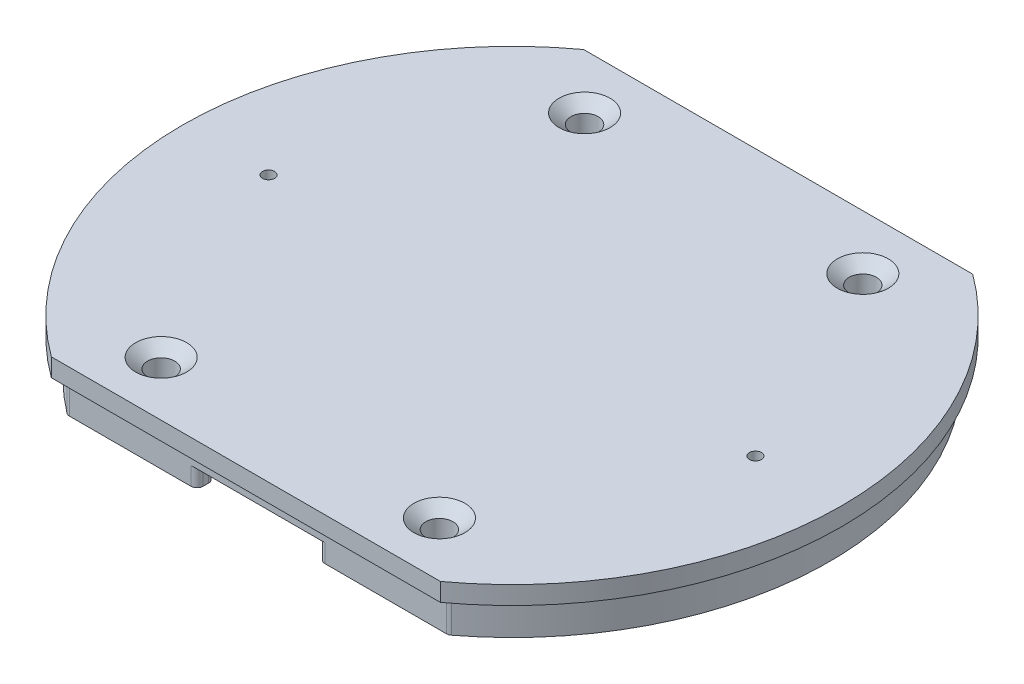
SolidWorks part; units mm, degrees
other "<a_base_t42>-<#8 Clearance Hole1>"
ref_plane "Front Plane" through (0, 0, 0) normal (0, 0, 1) x (1, 0, 0)
ref_plane "Top Plane" through (0, 0, 0) normal (0, 1, 0) x (1, 0, 0)
ref_plane "Right Plane" through (0, 0, 0) normal (1, 0, 0) x (0, 0, -1)
inserted part "a_base_t42"
inserted part "params_finger_t42"
sketch "Sketch1" plane through (0, 0, 0) normal (0, -1, 0) x (1, 0, 0)
  circle A0 centre (-23, 35) radius 2.2479 construction
  circle A1 centre (23, 35) radius 2.2479 construction
  circle A2 centre (23, -35) radius 2.2479 construction
  circle A3 centre (-23, -35) radius 2.2479 construction
  circle A4 centre (-23, 35) radius 2.2479
  circle A5 centre (23, 35) radius 2.2479
  circle A6 centre (23, -35) radius 2.2479
  circle A7 centre (-23, -35) radius 2.2479
  circle A8 centre (-23, 35) radius 5.2479
  circle A9 centre (23, 35) radius 5.2479
  circle A10 centre (23, -35) radius 5.2479
  circle A11 centre (-23, -35) radius 5.2479
  dimension "D1" = 3
extrude "Support Post Boss" add sketch "Sketch1" along normal blind 3
sketch "Sketch2" plane through (0, 0, 0) normal (0, -1, 0) x (1, 0, 0)
  line L0 (29.4321, 36) -> (-29.4321, 36)
  line L1 (-29.4321, -36) -> (29.4321, -36)
  line L2 (31.5, 42) -> (-31.5, 42)
  line L3 (-31.5, -42) -> (31.5, -42)
  line L4 (31.5, 42) -> (-31.5, 42)
  line L5 (-31.5, -42) -> (31.5, -42)
  arc A0 (-29.4321, 36) -> (-29.4321, -36) centre (0, 0) ccw
  arc A1 (29.4321, -36) -> (29.4321, 36) centre (0, 0) ccw
  arc A2 (31.5, -42) -> (31.5, 42) centre (0, 0) ccw
  arc A3 (-31.5, 42) -> (-31.5, -42) centre (0, 0) ccw
  arc A4 (31.5, -42) -> (31.5, 42) centre (0, 0) ccw
  arc A5 (-31.5, 42) -> (-31.5, -42) centre (0, 0) ccw
  dimension "D1" = 0
  dimension "D2" = 6
extrude "Inner Boss" add sketch "Sketch2" along normal up to surface (3 mm away)
sketch "Sketch3" plane through (0, 3, 0) normal (0, 1, 0) x (1, 0, 0)
  circle A0 centre (23, -35) radius 2.2479 construction
  circle A1 centre (-23, -35) radius 2.2479 construction
  circle A2 centre (-23, 35) radius 2.2479 construction
  circle A3 centre (23, 35) radius 2.2479 construction
  circle A4 centre (23, -35) radius 2.2479
  circle A5 centre (-23, -35) radius 2.2479
  circle A6 centre (-23, 35) radius 2.2479
  circle A7 centre (23, 35) radius 2.2479
extrude "Clearance - Support Restoration" cut sketch "Sketch3" against normal through all
sketch "Sketch4" plane through (0, 3, 0) normal (0, 1, 0) x (1, 0, 0)
  line L1 (-32.1598, -44) -> (32.1598, -44)
  line L2 (32.1598, 44) -> (-32.1598, 44)
  line L3 (-31.5, -42) -> (31.5, -42)
  line L4 (31.5, 42) -> (-31.5, 42)
  line L5 (-31.5, -42) -> (31.5, -42)
  line L6 (31.5, 42) -> (-31.5, 42)
  arc A0 (32.1598, -44) -> (32.1598, 44) centre (0, 0) ccw
  arc A1 (-32.1598, 44) -> (-32.1598, -44) centre (0, 0) ccw
  arc A2 (31.5, -42) -> (31.5, 42) centre (0, 0) ccw
  arc A3 (-31.5, 42) -> (-31.5, -42) centre (0, 0) ccw
  arc A4 (31.5, -42) -> (31.5, 42) centre (0, 0) ccw
  arc A5 (-31.5, 42) -> (-31.5, -42) centre (0, 0) ccw
  dimension "D1" = 0
  dimension "D2" = 2
extrude "Outer Shell Lip" add sketch "Sketch4" against normal blind 3
sketch "Sketch5" plane through (0, -3, 0) normal (0, -1, 0) x (1, 0, 0)
  line L0 (30.5094, 39.075) -> (-30.5094, 39.075)
  line L1 (-30.5094, -39.075) -> (30.5094, -39.075)
  line L2 (-31.5, -42) -> (31.5, -42)
  line L3 (31.5, 42) -> (-31.5, 42)
  line L4 (-31.5, -42) -> (31.5, -42)
  line L5 (31.5, 42) -> (-31.5, 42)
  arc A0 (-30.5094, 39.075) -> (-30.5094, -39.075) centre (0, 0) ccw
  arc A1 (30.5094, -39.075) -> (30.5094, 39.075) centre (0, 0) ccw
  arc A2 (31.5, -42) -> (31.5, 42) centre (0, 0) ccw
  arc A3 (-31.5, 42) -> (-31.5, -42) centre (0, 0) ccw
  arc A4 (31.5, -42) -> (31.5, 42) centre (0, 0) ccw
  arc A5 (-31.5, 42) -> (-31.5, -42) centre (0, 0) ccw
  dimension "D1" = 0
  dimension "D2" = 2.925
extrude "Inner Boss Outer Frame" add sketch "Sketch5" along normal blind 3
sketch "Sketch6" plane through (0, -6, 0) normal (0, -1, 0) x (1, 0, 0)
  line L0 (0, 42) -> (0, 0) construction
  line L1 (31.5, 42) -> (-31.5, 42) construction
  line L2 (0, 0) -> (52.5, 0) construction
  line L3 (30.5094, 39.075) -> (-30.5094, 39.075) construction
  line L4 (-10.075, 42) -> (10.075, 42)
  line L5 (-10.075, 42) -> (-10.075, 39.075)
  line L6 (-10.075, 39.075) -> (10.075, 39.075)
  line L7 (10.075, 42) -> (10.075, 39.075)
  line L8 (-10.075, -42) -> (-10.075, -39.075)
  line L9 (-10.075, -39.075) -> (10.075, -39.075)
  line L10 (10.075, -42) -> (10.075, -39.075)
  line L11 (-10.075, -42) -> (10.075, -42)
  arc A0 (31.5, -42) -> (31.5, 42) centre (0, 0) ccw construction
  dimension "D1" = 20.15
extrude "Clearance - Flange" cut sketch "Sketch6" against normal up to surface (3 mm away)
fillet "Contouring" radius 1 12 edges at (-10.075, -4.5, 39.075) (-10.075, -4.5, 42) (10.075, -4.5, 42) (10.075, -4.5, 39.075) (10.075, -4.5, -42) (-10.075, -4.5, -42) (-10.075, -4.5, -39.075) (10.075, -4.5, -39.075) (-31.5, -3, -42) (31.5, -3, -42) (-31.5, -3, 42) (31.5, -3, 42)
hole_wizard "CSK for #8 Flat Head Machine Screw (100)1" positions "Sketch8" profile "Sketch7" countersink size "#8" standard "ANSI Inch"
sketch "Sketch8" plane through (0, 3, 0) normal (0, 1, 0) x (1, 0, 0)
  point P0 (-23, 35)
  point P3 (23, 35)
  point P6 (23, -35)
  point P9 (-23, -35)
sketch "Sketch7" plane through (-23, 3, -35) normal (1, 0, 0) x (0, 0, 1)
  line L0 (0, 0) -> (0, 9)
  line L1 (0, 9) -> (2.1526, 9)
  line L2 (2.1526, 9) -> (2.1526, 1.7317)
  line L3 (2.1526, 1.7317) -> (4.2164, 0)
  line L5 (4.2164, 0) -> (0, 0)
  line L6 (-2.1527, 1.7317) -> (-4.2164, 0) construction
  line L11 (0, -6.35) -> (0, 107.95) construction
  dimension "Thru Hole Dia." = 4.3053
  dimension "Thru Hole Depth" = 9
  dimension "Near C'Sink Dia." = 8.4328
  dimension "Near C'Sink Angle" = 100
ref_point "Point1"
sketch "Sketch9" [suppressed] plane through (0, 3, 0) normal (0, 1, 0) x (1, 0, 0)
  line L0 (0, -44) -> (0, 44) construction
  line L1 (-32.1598, -44) -> (32.1598, -44) construction
  line L2 (32.1598, 44) -> (-32.1598, 44) construction
  line L3 (0, 0) -> (-54.5, 0) construction
  line L4 (41.75, -15.95) -> (41.75, 15.95)
  line L5 (-41.75, -15.95) -> (-12.0751, -15.95)
  line L6 (-41.75, -15.95) -> (-41.75, 15.95)
  line L7 (-41.75, 15.95) -> (-12.0751, 15.95)
  line L8 (-12.0751, -15.95) -> (-12.0751, 15.95)
  line L9 (41.75, 15.95) -> (12.0751, 15.95)
  line L10 (12.0751, -15.95) -> (12.0751, 15.95)
  line L11 (41.75, -15.95) -> (12.0751, -15.95)
  arc A0 (-32.1598, 44) -> (-32.1598, -44) centre (0, 0) ccw construction
  circle A1 centre (-40.25, 0) radius 1 construction
  point P17 (-38.75, 0)
  dimension "D1" = 1.5
  dimension "D2" = 31.9
  dimension "D3" = 38.75
  dimension "D4" = 26.6749
extrude "Clearance - Flexure Base" [suppressed] cut sketch "Sketch9" against normal up to surface (3 mm away)
sketch "Sketch10" [suppressed] plane through (0, 0, 0) normal (0, -1, 0) x (1, 0, 0)
  line L0 (0, -36) -> (0, 0) construction
  line L1 (-17.8483, -36) -> (17.8483, -36) construction
  line L2 (-41.75, -15.95) -> (-12.0751, -15.95) construction
  line L3 (-8.0751, -15.95) -> (-45.75, -15.95)
  line L4 (-8.0751, -15.95) -> (-8.0751, 15.95)
  line L5 (-8.0751, 15.95) -> (-45.75, 15.95)
  line L6 (-45.75, -15.95) -> (-45.75, 15.95)
  line L7 (-12.0751, 15.95) -> (-41.75, 15.95) construction
  line L8 (-12.0751, -15.95) -> (-12.0751, 15.95) construction
  line L9 (-41.75, 15.95) -> (-41.75, -15.95) construction
  line L10 (-5.0751, -18.95) -> (-48.75, -18.95)
  line L11 (-48.75, -18.95) -> (-48.75, 18.95)
  line L12 (-5.0751, 18.95) -> (-48.75, 18.95)
  line L13 (-5.0751, -18.95) -> (-5.0751, 18.95)
  line L14 (8.0751, -15.95) -> (8.0751, 15.95)
  line L15 (8.0751, 15.95) -> (45.75, 15.95)
  line L16 (45.75, -15.95) -> (45.75, 15.95)
  line L17 (8.0751, -15.95) -> (45.75, -15.95)
  line L18 (5.0751, -18.95) -> (5.0751, 18.95)
  line L19 (5.0751, 18.95) -> (48.75, 18.95)
  line L20 (48.75, -18.95) -> (48.75, 18.95)
  line L21 (5.0751, -18.95) -> (48.75, -18.95)
  dimension "D1" = 4
  dimension "D2" = 4
  dimension "D3" = 3
extrude "Framing - Flexure Base" [suppressed] add sketch "Sketch10" along normal up to surface (3 mm away)
sketch "Sketch11" [suppressed] plane through (0, -3, 0) normal (0, -1, 0) x (1, 0, 0)
  line L0 (41.75, -15.95) -> (41.75, 15.95) construction
  line L1 (41.75, -15.95) -> (41.75, 15.95)
  line L2 (0, 0) -> (0, -36) construction
  line L3 (-17.8483, -36) -> (17.8483, -36) construction
  line L4 (41.75, -15.95) -> (45.75, -15.95)
  line L5 (45.75, -15.95) -> (45.75, 15.95)
  line L6 (45.75, 15.95) -> (41.75, 15.95)
  line L7 (45.75, -8.3179) -> (45.75, 8.3179) construction
  line L8 (-45.75, 15.95) -> (-41.75, 15.95)
  line L9 (-45.75, -15.95) -> (-45.75, 15.95)
  line L10 (-41.75, -15.95) -> (-45.75, -15.95)
  line L11 (-41.75, -15.95) -> (-41.75, 15.95)
extrude "Clearance - Flexure Tab" [suppressed] cut sketch "Sketch11" against normal up to surface (3 mm away)
sketch "Sketch12" [suppressed] plane through (0, 3, 0) normal (0, 1, 0) x (1, 0, 0)
  line L0 (0, -44) -> (0, 0) construction
  line L1 (-32.1598, -44) -> (32.1598, -44) construction
  line L2 (0, 0) -> (54.5, 0) construction
  line L3 (-41.75, -15.95) -> (-41.75, 15.95)
  line L4 (41.75, -15.95) -> (20.85, -15.95)
  line L5 (41.75, -15.95) -> (41.75, 15.95)
  line L6 (41.75, 15.95) -> (20.85, 15.95)
  line L7 (20.85, -15.95) -> (20.85, 15.95)
  line L8 (-41.75, 15.95) -> (-20.85, 15.95)
  line L9 (-20.85, -15.95) -> (-20.85, 15.95)
  line L10 (-41.75, -15.95) -> (-20.85, -15.95)
  arc A0 (32.1598, -44) -> (32.1598, 44) centre (0, 0) ccw construction
  circle A1 centre (40.25, 0) radius 1 construction
  point P15 (30, 0)
  dimension "D1" = 1.5
  dimension "D2" = 31.9
  dimension "D3" = 30
  dimension "D4" = 9.15
extrude "Clearance - Pivot Base" [suppressed] cut sketch "Sketch12" against normal up to surface (3 mm away)
sketch "Sketch13" [suppressed] plane through (0, 0, 0) normal (0, -1, 0) x (1, 0, 0)
  line L0 (0, 0) -> (0, -44) construction
  line L1 (32.1598, -44) -> (-32.1598, -44) construction
  line L2 (-41.75, -15.95) -> (-20.85, -15.95) construction
  line L3 (-16.85, -15.95) -> (-45.75, -15.95)
  line L4 (-16.85, -15.95) -> (-16.85, 15.95)
  line L5 (-16.85, 15.95) -> (-45.75, 15.95)
  line L6 (-45.75, -15.95) -> (-45.75, 15.95)
  line L7 (-20.85, 15.95) -> (-41.75, 15.95) construction
  line L8 (-20.85, -15.95) -> (-20.85, 15.95) construction
  line L9 (-41.75, 15.95) -> (-41.75, -15.95) construction
  line L10 (-13.85, -18.95) -> (-48.75, -18.95)
  line L11 (-48.75, -18.95) -> (-48.75, 18.95)
  line L12 (-13.85, 18.95) -> (-48.75, 18.95)
  line L13 (-13.85, -18.95) -> (-13.85, 18.95)
  line L14 (16.85, -15.95) -> (16.85, 15.95)
  line L15 (16.85, 15.95) -> (45.75, 15.95)
  line L16 (45.75, -15.95) -> (45.75, 15.95)
  line L17 (16.85, -15.95) -> (45.75, -15.95)
  line L18 (13.85, -18.95) -> (13.85, 18.95)
  line L19 (13.85, 18.95) -> (48.75, 18.95)
  line L20 (48.75, -18.95) -> (48.75, 18.95)
  line L21 (13.85, -18.95) -> (48.75, -18.95)
  dimension "D1" = 4
  dimension "D2" = 4
  dimension "D3" = 3
extrude "Framing - Pivot Base" [suppressed] add sketch "Sketch13" along normal up to surface (3 mm away)
sketch "Sketch14" [suppressed] plane through (0, -3, 0) normal (0, -1, 0) x (1, 0, 0)
  line L0 (41.75, -15.95) -> (41.75, 15.95) construction
  line L2 (41.75, -15.95) -> (41.75, 15.95)
  line L3 (0, 0) -> (0, -53.8767) construction
  line L5 (41.75, -15.95) -> (45.75, -15.95)
  line L6 (45.75, -15.95) -> (45.75, 15.95)
  line L7 (45.75, 15.95) -> (41.75, 15.95)
  line L8 (45.75, -8.3179) -> (45.75, 8.3179) construction
  line L9 (-45.75, 15.95) -> (-41.75, 15.95)
  line L10 (-45.75, -15.95) -> (-45.75, 15.95)
  line L11 (-41.75, -15.95) -> (-45.75, -15.95)
  line L12 (-41.75, -15.95) -> (-41.75, 15.95)
extrude "Clearance - Pivot Tab" [suppressed] cut sketch "Sketch14" against normal up to surface (3 mm away)
sketch "Sketch15" [suppressed] plane through (0, 3, 0) normal (0, 1, 0) x (1, 0, 0)
  line L0 (0, -44) -> (0, 0) construction
  line L1 (41.825, -15.95) -> (-41.825, -15.95)
  line L2 (41.825, -15.95) -> (41.825, 15.95)
  line L3 (41.825, 15.95) -> (-41.825, 15.95)
  line L4 (-41.825, -15.95) -> (-41.825, 15.95)
  line L5 (-32.1598, -44) -> (32.1598, -44) construction
  line L6 (0, 0) -> (54.5, 0) construction
  arc A0 (32.1598, -44) -> (32.1598, 44) centre (0, 0) ccw construction
  circle A1 centre (40.25, 0) radius 1 construction
  dimension "D1" = 1.575
  dimension "D2" = 31.9
extrude "Clearance - Single Base" [suppressed] cut sketch "Sketch15" against normal up to next
sketch "Sketch16" [suppressed] plane through (0, 0, 0) normal (0, -1, 0) x (1, 0, 0)
  line L0 (0, 0) -> (0, -56.5235) construction
  line L1 (45.825, -15.95) -> (-45.825, -15.95)
  line L2 (45.825, -15.95) -> (45.825, 15.95)
  line L3 (45.825, 15.95) -> (-45.825, 15.95)
  line L4 (-45.825, -15.95) -> (-45.825, 15.95)
  line L5 (-41.825, -15.95) -> (41.825, -15.95) construction
  line L6 (41.825, 15.95) -> (-41.825, 15.95) construction
  line L7 (41.825, -15.95) -> (41.825, 15.95) construction
  line L8 (48.825, -18.95) -> (-48.825, -18.95)
  line L9 (-48.825, -18.95) -> (-48.825, 18.95)
  line L10 (48.825, 18.95) -> (-48.825, 18.95)
  line L11 (48.825, -18.95) -> (48.825, 18.95)
  dimension "D1" = 4
  dimension "D2" = 3
extrude "Framing - Single Base" [suppressed] add sketch "Sketch16" along normal up to surface (3 mm away)
sketch "Sketch17" [suppressed] plane through (0, 0, 0) normal (0, -1, 0) x (1, 0, 0)
  line L0 (41.825, -15.95) -> (41.825, 15.95) construction
  line L1 (41.825, -15.95) -> (41.825, 15.95)
  line L2 (0, 0) -> (0, -52.1923) construction
  line L3 (41.825, -15.95) -> (45.825, -15.95)
  line L4 (45.825, -15.95) -> (45.825, 15.95)
  line L5 (45.825, 15.95) -> (41.825, 15.95)
  line L6 (45.825, -7.8943) -> (45.825, 7.8943) construction
  line L7 (-45.825, 15.95) -> (-41.825, 15.95)
  line L8 (-45.825, -15.95) -> (-45.825, 15.95)
  line L9 (-41.825, -15.95) -> (-45.825, -15.95)
  line L10 (-41.825, -15.95) -> (-41.825, 15.95)
extrude "Clearance - Single Tab" [suppressed] cut sketch "Sketch17" along normal up to surface (3 mm away)
equation "\"D1@Sketch1\"=\"width keep@values@params_print.SLDPRT\""
equation "\"D1@Support Post Boss\"=\"width keep@values@params_print.SLDPRT\""
equation "\"D2@Sketch2\"=2*\"width keep@values@params_print.SLDPRT\""
equation "\"D1@Outer Shell Lip\"=\"width keep@values@params_print.SLDPRT\""
equation "\"D2@Sketch5\"=\"width keep@values@params_print.SLDPRT\"-\"print fit@values@params_print.SLDPRT\"/2"
equation "\"D1@Inner Boss Outer Frame\"=\"width keep@values@params_print.SLDPRT\""
equation "\"D1@Sketch6\"=20+\"print fit@values@params_print.SLDPRT\""
equation "\"D1@Sketch9\"=\"width keep@values@params_print.SLDPRT\"/2"
equation "\"D2@Sketch9\"=\"depth@values@params_finger_t42.SLDPRT\"+\"print fit@values@params_print.SLDPRT\""
equation "\"D3@Sketch9\"=\"Lb@values@params_finger_t42.SLDPRT\"/2"
equation "\"D4@Sketch9\"=4*\"width keep@values@params_print.SLDPRT\"+1.5*\"base pin diameter@values@params_print.SLDPRT\"+\"Kp length@values@params_finger_t42.SLDPRT\"/2*cos(\"Tp@values@params_finger_t42.SLDPRT\"/180*pi)"
equation "\"D1@Sketch10\"=\"width tab@values@params_print.SLDPRT\""
equation "\"D2@Sketch10\"=\"width tab@values@params_print.SLDPRT\""
equation "\"D3@Sketch10\"=\"width keep@values@params_print.SLDPRT\""
equation "\"D1@Sketch12\"=\"width keep@values@params_print.SLDPRT\"/2"
equation "\"D2@Sketch12\"=\"depth@values@params_finger_t42.SLDPRT\"+\"print fit@values@params_print.SLDPRT\""
equation "\"D3@Sketch12\"=\"Lb Pivot@values@params_finger_t42.SLDPRT\"/2"
equation "\"D4@Sketch12\"=\"height@values@params_finger_t42.SLDPRT\"/2+\"print fit@values@params_print.SLDPRT\""
equation "\"D1@Sketch13\"=\"width tab@values@params_print.SLDPRT\""
equation "\"D2@Sketch13\"=\"width tab@values@params_print.SLDPRT\""
equation "\"D3@Sketch13\"=\"width keep@values@params_print.SLDPRT\""
equation "\"D1@Sketch15\"=\"width keep@values@params_print.SLDPRT\"/2+\"print fit@values@params_print.SLDPRT\"/2"
equation "\"D2@Sketch15\"=\"depth@values@params_finger_t42.SLDPRT\"+\"print fit@values@params_print.SLDPRT\""
equation "\"D1@Sketch16\"=\"width tab@values@params_print.SLDPRT\""
equation "\"D2@Sketch16\"=\"width keep@values@params_print.SLDPRT\""
